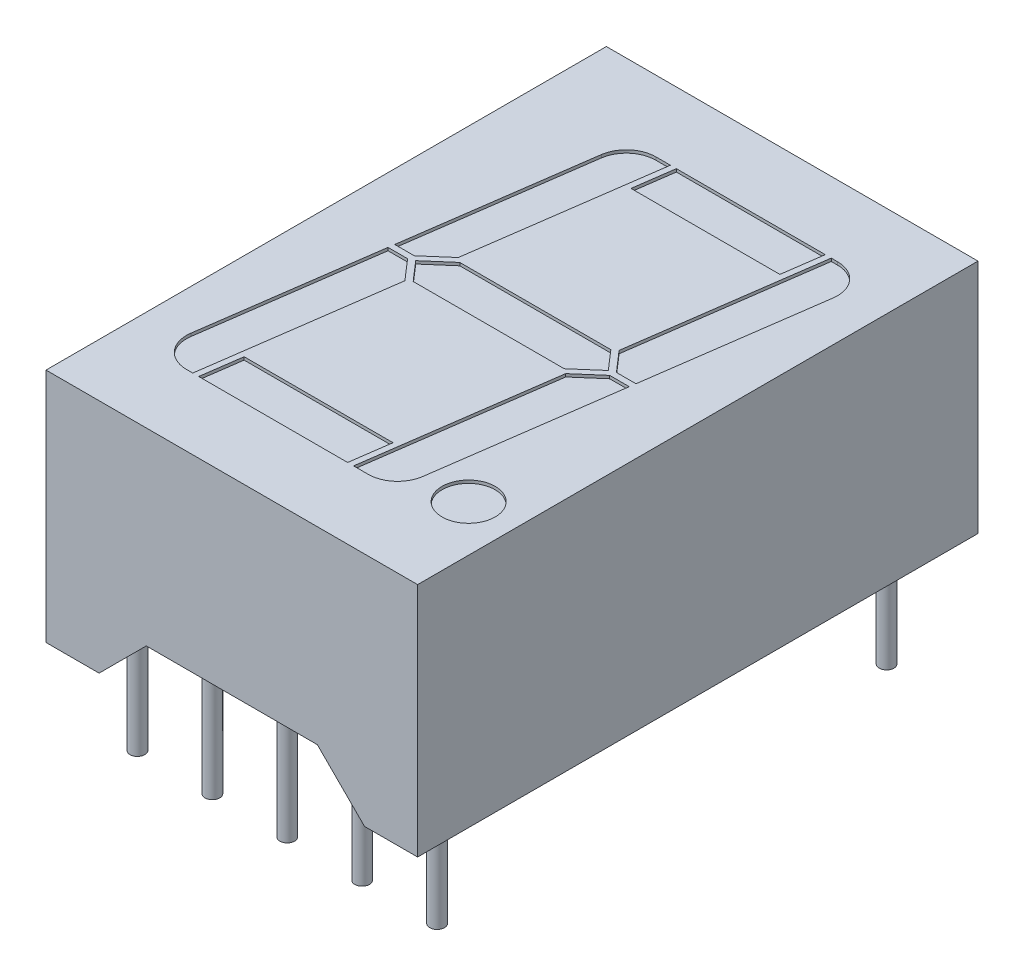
SolidWorks part; units mm, degrees
ref_plane "Front" through (0, 0, 0) normal (0, 0, 1) x (1, 0, 0)
ref_plane "Top" through (0, 0, 0) normal (0, 1, 0) x (1, 0, 0)
ref_plane "Right" through (0, 0, 0) normal (1, 0, 0) x (0, 0, -1)
sketch "Эскиз1" plane through (0, 0, 0) normal (0, 0, 1) x (1, 0, 0)
  line L0 (-6.3, 0) -> (-4.5, 0)
  line L1 (-4.5, 0) -> (-2.9, 1.6)
  line L2 (-6.3, 0) -> (-6.3, 8)
  line L3 (-6.3, 8) -> (6.3, 8)
  line L4 (6.3, 0) -> (6.3, 8)
  line L5 (-2.9, 1.6) -> (2.9, 1.6)
  line L6 (0, 1.6) -> (0, 0) construction
  line L7 (4.5, 0) -> (2.9, 1.6)
  line L8 (6.3, 0) -> (4.5, 0)
  dimension "D1" = 8
  dimension "D2" = 12.6
  dimension "D3" = 9
  dimension "D4" = 1.6
  dimension "D5" = 45
extrude "Вытянуть1" add sketch "Эскиз1" along normal mid plane 19
sketch "Эскиз2" plane through (0, 0, 0) normal (0, 1, 0) x (1, 0, 0)
  line L0 (0, 7.62) -> (0, -7.62) construction
  circle A0 centre (-5.08, 7.62) radius 0.25
  circle A1 centre (-2.54, 7.62) radius 0.25
  circle A2 centre (0, 7.62) radius 0.25
  circle A3 centre (2.54, 7.62) radius 0.25
  circle A4 centre (5.08, 7.62) radius 0.25
  circle A5 centre (-5.08, -7.62) radius 0.25
  circle A6 centre (-2.54, -7.62) radius 0.25
  circle A7 centre (0, -7.62) radius 0.25
  circle A8 centre (2.54, -7.62) radius 0.25
  circle A9 centre (5.08, -7.62) radius 0.25
  dimension "D1" = 0.5
  dimension "D2" = 15.24
  dimension "D3" = 2.54
extrude "Вытянуть2" add sketch "Эскиз2" against normal blind 3.5 and the other way blind 2.5
sketch "Эскиз3" plane through (0, 8, 0) normal (0, 1, 0) x (-1, 0, 0)
  line L0 (4.9275, 5.9608) -> (4.1039, 0.1)
  line L1 (4.1039, 0.1) -> (3.4406, 0.1)
  line L2 (2.838, 0.7932) -> (3.7244, 7.1)
  line L3 (3.7244, 7.1) -> (3.9373, 7.1)
  line L4 (4.0757, -0.1) -> (3.2129, -6.2392)
  line L5 (2.2227, -7.1) -> (1.7287, -7.1)
  line L6 (1.7287, -7.1) -> (2.6151, -0.7932)
  line L7 (3.4125, -0.1) -> (4.0757, -0.1)
  line L8 (-2.838, -0.7932) -> (-3.7244, -7.1)
  line L9 (-3.7244, -7.1) -> (-3.9373, -7.1)
  line L10 (-4.9275, -5.9608) -> (-4.1039, -0.1)
  line L11 (-4.1039, -0.1) -> (-3.4406, -0.1)
  line L12 (-1.7287, 7.1) -> (-2.6151, 0.7932)
  line L13 (-3.4125, 0.1) -> (-4.0757, 0.1)
  line L14 (-4.0757, 0.1) -> (-3.2129, 6.2392)
  line L15 (-2.2227, 7.1) -> (-1.7287, 7.1)
  line L16 (3.5224, 7.1) -> (3.3327, 5.75)
  line L17 (3.3327, 5.75) -> (-1.7165, 5.75)
  line L18 (-1.7165, 5.75) -> (-1.5267, 7.1)
  line L19 (-1.5267, 7.1) -> (3.5224, 7.1)
  line L20 (1.7165, -5.75) -> (-3.3327, -5.75)
  line L21 (1.7165, -5.75) -> (1.5267, -7.1)
  line L22 (-3.3327, -5.75) -> (-3.5224, -7.1)
  line L23 (1.5267, -7.1) -> (-3.5224, -7.1)
  line L24 (0, 0) -> (0, -9.5) construction
  line L25 (-6.3, -9.5) -> (6.3, -9.5) construction
  line L26 (2.6151, -0.7932) -> (3.4125, -0.1)
  line L27 (3.4406, 0.1) -> (2.838, 0.7932)
  line L28 (-3.4406, -0.1) -> (-2.838, -0.7932)
  line L29 (-2.6151, 0.7932) -> (-3.4125, 0.1)
  line L30 (2.4462, -0.675) -> (-2.6757, -0.675)
  line L31 (2.4838, -0.6422) -> (3.2813, 0.0509) construction
  line L32 (3.2896, -0.0312) -> (2.6871, 0.662) construction
  line L33 (-3.2896, 0.0312) -> (-2.6871, -0.662) construction
  line L34 (-2.4838, 0.6422) -> (-3.2813, -0.0509) construction
  line L35 (-2.4462, 0.675) -> (2.6757, 0.675)
  line L36 (-3.2454, -0.0197) -> (-2.6757, -0.675)
  line L37 (2.4462, -0.675) -> (3.2454, 0.0197)
  line L38 (3.2454, 0.0197) -> (2.6757, 0.675)
  line L39 (-2.4462, 0.675) -> (-3.2454, -0.0197)
  line L40 (0, 0) -> (6.3, 0) construction
  line L41 (6.3, 9.5) -> (6.3, -9.5) construction
  line L42 (-0.1148, -0.675) -> (0.1148, 0.675) construction
  arc A0 (4.9275, 5.9608) -> (3.9373, 7.1) centre (3.9373, 6.1) ccw
  arc A1 (-3.2129, 6.2392) -> (-2.2227, 7.1) centre (-2.2227, 6.1) cw
  arc A2 (3.2129, -6.2392) -> (2.2227, -7.1) centre (2.2227, -6.1) cw
  arc A3 (-3.9373, -7.1) -> (-4.9275, -5.9608) centre (-3.9373, -6.1) cw
  circle A4 centre (-4.7287, 6.2) radius 0.9
  point P3 (2.7406, 0.1)
  point P7 (2.7125, -0.1)
  point P8 (-2.7406, -0.1)
  point P13 (-2.7125, 0.1)
  dimension "D16" = 1
  dimension "D18" = 1.8
  dimension "D1" = 0.2
  dimension "D2" = 0.2
  dimension "D3" = 0.2
  dimension "D4" = 8.1
  dimension "D5" = 1.35
  dimension "D6" = 1.35
  dimension "D7" = 8
  dimension "D9" = 1.35
  dimension "D14" = 1.35
  dimension "D15" = 14.2
  dimension "D17" = 3
  dimension "D8" = 0.2
extrude "Вытянуть3" cut sketch "Эскиз3" against normal blind 0.1
equation "\"D2@Эскиз3\" = \"D1@Эскиз3\""
equation "\"D3@Эскиз3\" = \"D1@Эскиз3\""
